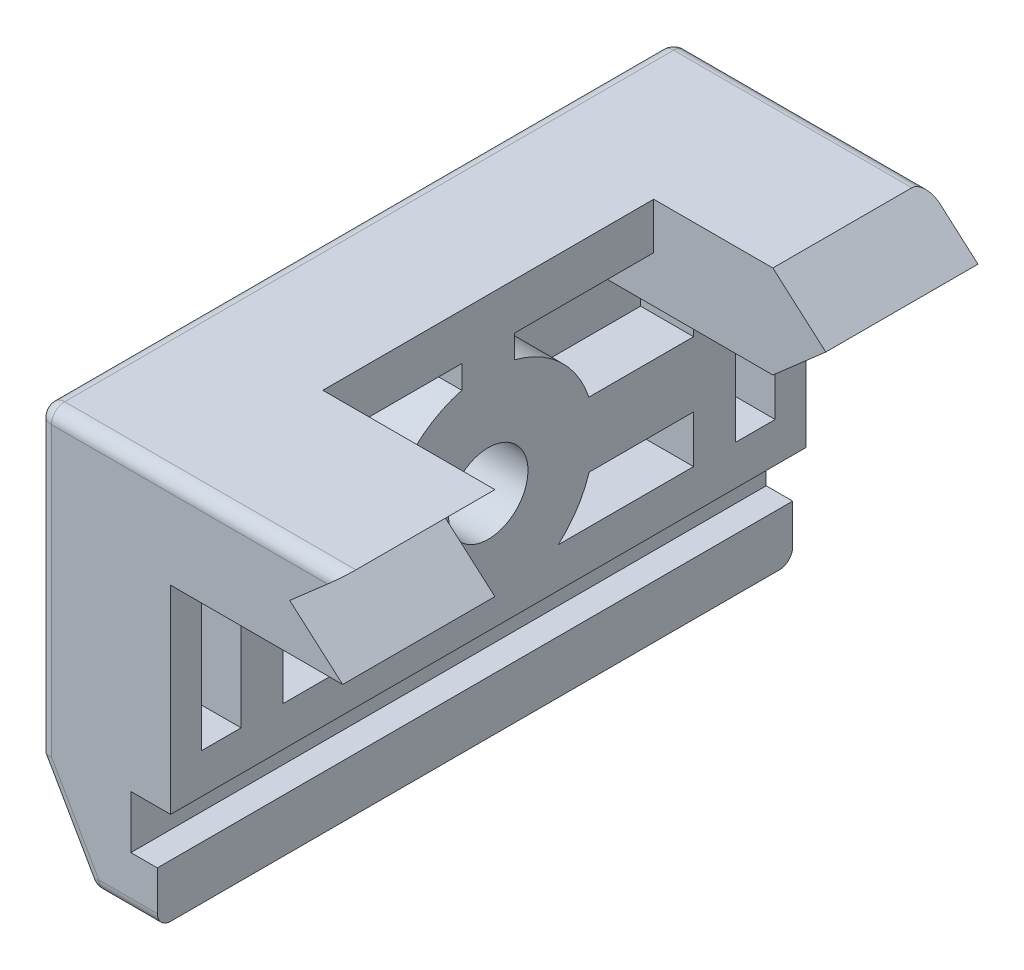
SolidWorks part; units mm, degrees
ref_plane "Plane1" through (0, 0, 0) normal (0, 0, 1) x (1, 0, 0)
ref_plane "Plane2" through (0, 0, 0) normal (0, 1, 0) x (1, 0, 0)
ref_plane "Plane3" through (0, 0, 0) normal (1, 0, 0) x (0, 0, -1)
sketch "Esquisse1" plane through (0, 0, 0) normal (0, 0, 1) x (1, 0, 0)
  line L0 (0, 0) -> (4, 0)
  line L1 (4, 0) -> (4, -7)
  line L2 (4, -7) -> (-9, -7)
  line L3 (-9, -7) -> (-9, -22)
  line L4 (-10, -30) -> (-15, -30)
  line L5 (-19, 0) -> (-19, -23)
  line L6 (-19, -23) -> (-15, -30)
  line L11 (-19, 0) -> (0, 0)
  line L12 (-9, -22) -> (-12, -22)
  line L13 (-12, -22) -> (-12, -26)
  line L14 (-12, -26) -> (-10, -26)
  line L15 (-10, -26) -> (-10, -30)
  dimension "D1" = 7
  dimension "D2" = 26
  dimension "D3" = 3
  dimension "D4" = 22
  dimension "D5" = 30
  dimension "D6" = 23
  dimension "D7" = 10
  dimension "D8" = 4
  dimension "D9" = 7
extrude "Base-Extrusion" add sketch "Esquisse1" along normal blind 48
sketch "Esquisse2" plane through (0, -7, 0) normal (0, -1, 0) x (1, 0, 0)
  line L0 (4, 36.5) -> (-9, 36.5)
  line L1 (4, 36.5) -> (4, 11.5)
  line L2 (-9, 11.5) -> (4, 11.5)
  line L3 (-9, 11.5) -> (-9, 36.5)
  line L4 (4, 48) -> (4, 0) construction
  line L5 (4, 48) -> (-9, 48) construction
  line L6 (4, 0) -> (-9, 0) construction
  dimension "D1" = 11.5
  dimension "D2" = 25
  dimension "D3" = 11.5
  dimension "D4" = 13
extrude "Enlèv. mat.-Extru.1" cut sketch "Esquisse2" against normal blind 48
sketch "Esquisse4" plane through (0, 0, 48) normal (0, 0, 1) x (1, 0, 0)
  line L0 (4, 0) -> (4, -7)
  line L4 (4, 0) -> (4, -7) construction
  line L5 (0, -3.5) -> (4, 0)
  line L6 (4, -7) -> (0, -3.5)
extrude "Enlèv. mat.-Extru.2" cut sketch "Esquisse4" against normal blind 15
sketch "Esquisse5" plane through (0, 0, 0) normal (0, 0, -1) x (-1, 0, 0)
  line L0 (0, 0) -> (-4, 0)
  line L1 (19, 0) -> (-4, 0) construction
  line L2 (-4, 0) -> (-4, -3.5)
  line L3 (-4, 0) -> (-4, -7) construction
  line L4 (-4, -3.5) -> (0, 0)
  dimension "D1" = 3.5
  dimension "D2" = 4
extrude "Enlèv. mat.-Extru.3" cut sketch "Esquisse5" against normal blind 15
sketch "Esquisse6" plane through (0, 0, 0) normal (0, 0, -1) x (-1, 0, 0)
  line L0 (-4, -3.5) -> (0, -7)
  line L1 (-4, -7) -> (9, -7) construction
  line L2 (0, -7) -> (-4, -7)
  line L3 (-4, -7) -> (-4, -3.5)
extrude "Enlèv. mat.-Extru.4" cut sketch "Esquisse6" against normal blind 15
fillet "Congé1" radius 1
fillet "Congé2" radius 1
fillet "Congé3" radius 1
fillet "Congé4" radius 1
sketch "Esquisse7" plane through (-9, 0, 0) normal (1, 0, 0) x (0, 0, -1)
  line L0 (-48, -7) -> (-48, -22) construction
  line L1 (-36.5, 0) -> (-11.5, 0) construction
  circle A0 centre (-24, -13) radius 3
  dimension "D1" = 6
  dimension "D2" = 24
  dimension "D3" = 13
extrude "Enlèv. mat.-Extru.5" cut sketch "Esquisse7" against normal blind 15
sketch "Esquisse8" plane through (-9, 0, 0) normal (1, 0, 0) x (0, 0, -1)
  line L0 (-36.5, -3.5) -> (-25.999, -3.5)
  line L1 (-36.5, -3.5) -> (-36.5, -7)
  line L2 (-36.5, -7) -> (-39.5083, -7)
  line L3 (-48, -7) -> (-36.5, -7) construction
  line L4 (-39.5083, -7) -> (-39.5083, -10.5)
  line L5 (-39.5083, -10.5) -> (-31.5993, -10.5)
  line L6 (-25.999, -5.2538) -> (-25.999, -3.5)
  line L7 (-24, -13) -> (-24, 10.6967) construction
  line L8 (-22.001, -5.2538) -> (-22.001, -3.5)
  line L9 (-11.5, -3.5) -> (-22.001, -3.5)
  line L10 (-11.5, -3.5) -> (-11.5, -7)
  line L11 (-11.5, -7) -> (-8.4917, -7)
  line L12 (-8.4917, -7) -> (-8.4917, -10.5)
  line L13 (-8.4917, -10.5) -> (-16.4007, -10.5)
  line L14 (-45.6765, -7) -> (-42.6765, -7)
  line L15 (-45.6765, -7) -> (-45.6765, -19)
  line L17 (-42.6765, -7) -> (-42.6765, -19)
  line L19 (-42.6765, -19) -> (-45.6765, -19)
  line L20 (-2.3235, -7) -> (-5.3235, -7)
  line L21 (-2.3235, -7) -> (-2.3235, -19)
  line L22 (-5.3235, -19) -> (-2.3235, -19)
  line L23 (-5.3235, -7) -> (-5.3235, -19)
  line L24 (-39.5083, -15.42) -> (-39.5083, -19)
  line L25 (-39.5083, -19) -> (-29.2915, -19)
  line L26 (-39.5083, -15.42) -> (-31.6252, -15.42)
  line L27 (-40.8322, -13) -> (-24, -13) construction
  line L28 (-8.4917, -15.42) -> (-8.4917, -19)
  line L29 (-8.4917, -15.42) -> (-16.3748, -15.42)
  line L30 (-8.4917, -19) -> (-18.7085, -19)
  arc A0 (-25.999, -5.2538) -> (-31.5993, -10.5) centre (-24, -13) ccw
  arc A1 (-31.6252, -15.42) -> (-29.2915, -19) centre (-24, -13) ccw
  arc A2 (-18.7085, -19) -> (-16.3748, -15.42) centre (-24, -13) ccw
  arc A3 (-16.4007, -10.5) -> (-22.001, -5.2538) centre (-24, -13) ccw
  dimension "D1" = 16
  dimension "D2" = 7
  dimension "D3" = 12
extrude "Enlèv. mat.-Extru.6" cut sketch "Esquisse8" against normal blind 4
sketch "Esquisse9" plane through (-19, 0, 0) normal (-1, 0, 0) x (0, 0, 1)
  circle A0 centre (24, -13) radius 6
  dimension "D1" = 12
extrude "Enlèv. mat.-Extru.7" cut sketch "Esquisse9" against normal blind 3
